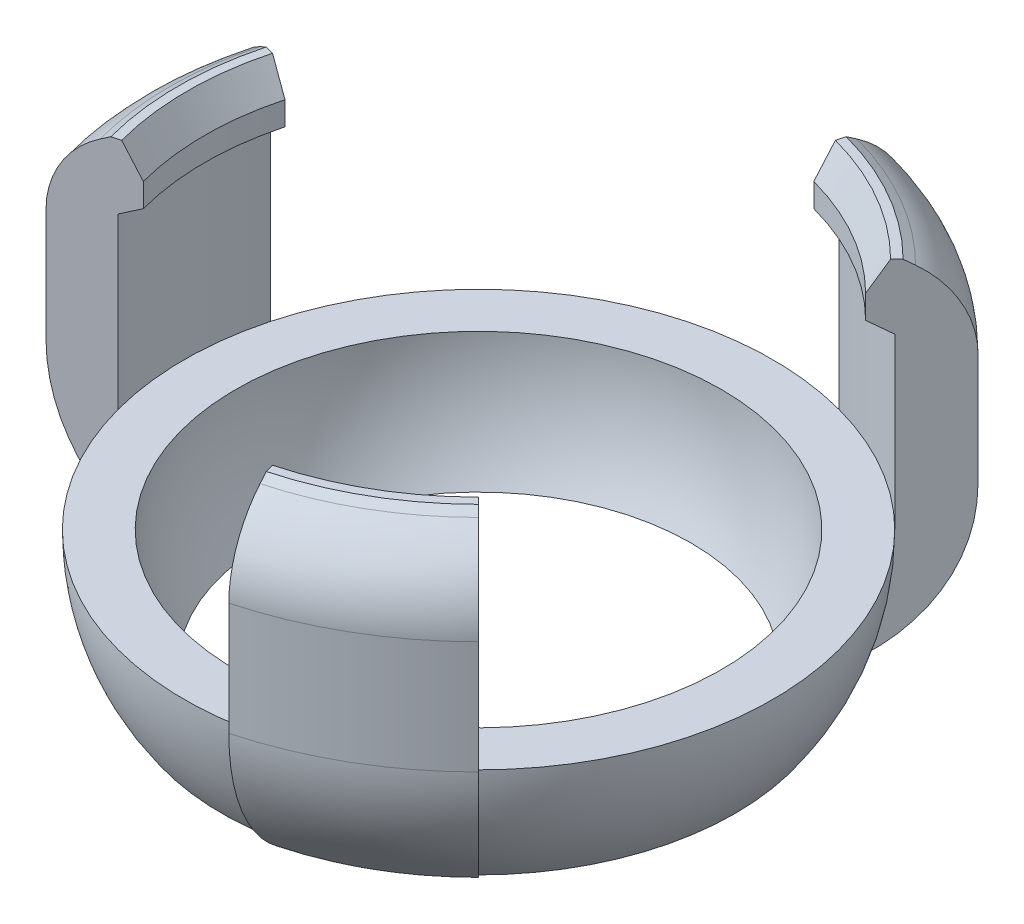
SolidWorks part; units mm, degrees
ref_plane "Plan de face" through (0, 0, 0) normal (0, 0, 1) x (1, 0, 0)
ref_plane "Plan de dessus" through (0, 0, 0) normal (0, 1, 0) x (1, 0, 0)
ref_plane "Plan de droite" through (0, 0, 0) normal (1, 0, 0) x (0, 0, -1)
sketch "Esquisse1" plane through (0, 0, 0) normal (0, 0, 1) x (1, 0, 0)
  line L0 (8.25, 0) -> (10, 0)
  line L1 (10, 0) -> (10, 5.75)
  line L2 (10, 5.75) -> (9.3, 6.1541)
  line L4 (9.9, 7.9541) -> (10.2, 7.9541)
  line L5 (10.2, 7.9541) -> (10.5, 7.7809)
  line L6 (12, 5.1829) -> (12, 1.3504)
  line L9 (0, 0) -> (0, 12.2513) construction
  line L10 (9.3, 6.9541) -> (9.3, 6.1541)
  line L11 (7.2154, -4) -> (8.7154, -4)
  line L12 (9.9, 7.9541) -> (9.3, 6.9541)
  arc A0 (8.25, 0) -> (7.2154, -4) centre (0, 0) cw
  arc A2 (12, 1.3504) -> (8.7154, -4) centre (6, 1.3504) cw
  arc A3 (12, 5.1829) -> (10.5, 7.7809) centre (9, 5.1829) ccw
  point P10 (9.125, 0)
  dimension "D1" = 8.25
  dimension "D11" = 3
  dimension "D12" = 6
  dimension "D2" = 10
  dimension "D3" = 5.75
  dimension "D4" = 120
  dimension "D5" = 4
  dimension "D6" = 0.7
  dimension "D7" = 2
  dimension "D8" = 1
  dimension "D9" = 1.5
  dimension "D10" = 0.6
  dimension "D13" = 0.9
  dimension "D14" = 1.8
revolve "Révolution1" add sketch "Esquisse1" angle 360 about L9
sketch "Esquisse2" plane through (0, 0, 0) normal (0, 0, 1) x (1, 0, 0)
  line L0 (6.6107, 0) -> (6.6107, 10.7715)
  line L1 (10, 0) -> (-10, 0) construction
  line L2 (6.6107, 10.7715) -> (14.2966, 10.7715)
  line L3 (6.6107, 0) -> (10, 0)
  line L4 (-8.7154, -4) -> (8.7154, -4) construction
  line L5 (8.7154, -4) -> (14.2966, -4)
  line L6 (14.2966, -4) -> (14.2966, 10.7715)
  line L7 (0, 0) -> (0, 12.4456) construction
  line L8 (10, 0) -> (10, 5.75) construction
  arc A0 (10, 0) -> (8.7154, -4) centre (3.1299, 0) cw
  arc A1 (8.7154, -4) -> (12, 1.3504) centre (6, 1.3504) ccw construction
revolve "Enlèvement de matière-Révolution1" cut sketch "Esquisse2" angle 45 about L7
pattern_circular "Répétition circulaire1" count 3 every 120 about axis through (0, 0, 0) along (0, 1, 0) of "Enlèvement de matière-Révolution1"
